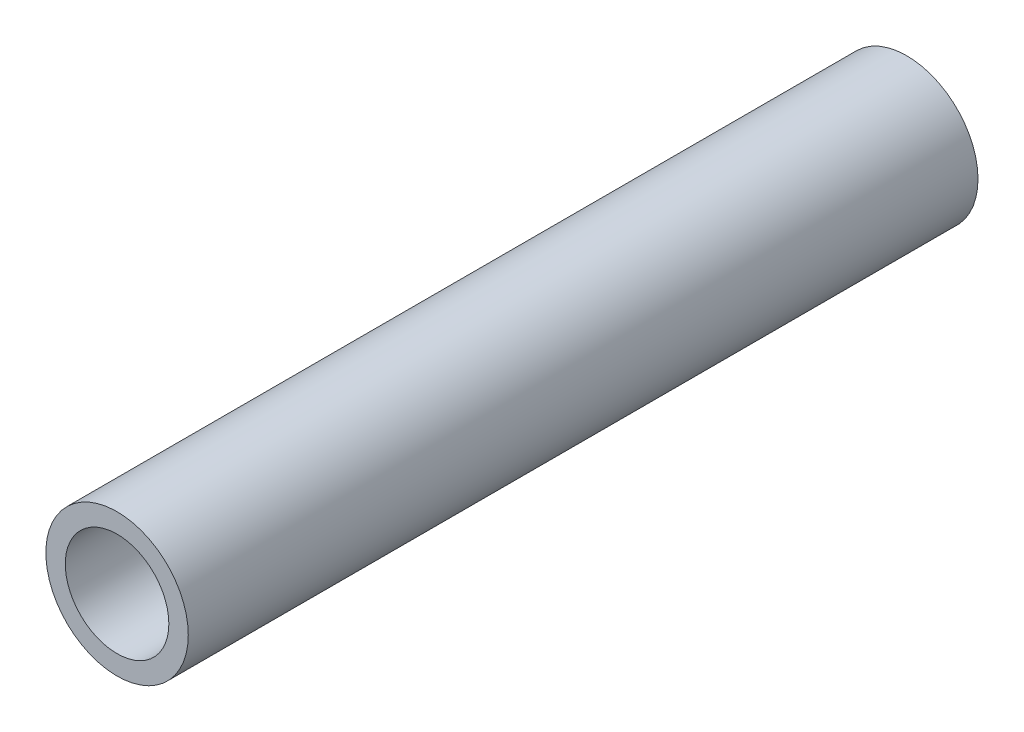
SolidWorks part; units mm, degrees
ref_plane "Front Plane" through (0, 0, 0) normal (0, 0, 1) x (1, 0, 0)
ref_plane "Top Plane" through (0, 0, 0) normal (0, 1, 0) x (1, 0, 0)
ref_plane "Right Plane" through (0, 0, 0) normal (1, 0, 0) x (0, 0, -1)
sketch "Sketch1" plane through (0, 0, 0) normal (0, 0, 1) x (1, 0, 0)
  circle A0 centre (0, 0) radius 27.94
  dimension "D1" = 55.88
extrude "Boss-Extrude1" add sketch "Sketch1" along normal blind 309.88
sketch "Sketch2" plane through (0, 0, 309.88) normal (0, 0, 1) x (1, 0, 0)
  circle A0 centre (0, 0) radius 20.32
extrude "Cut-Extrude1" cut sketch "Sketch2" against normal blind 254
sketch "Sketch3" plane through (0, 0, 0) normal (0, 0, -1) x (-1, 0, 0)
  circle A0 centre (0, 0) radius 20.32
extrude "Cut-Extrude2" cut sketch "Sketch3" against normal blind 50.8
